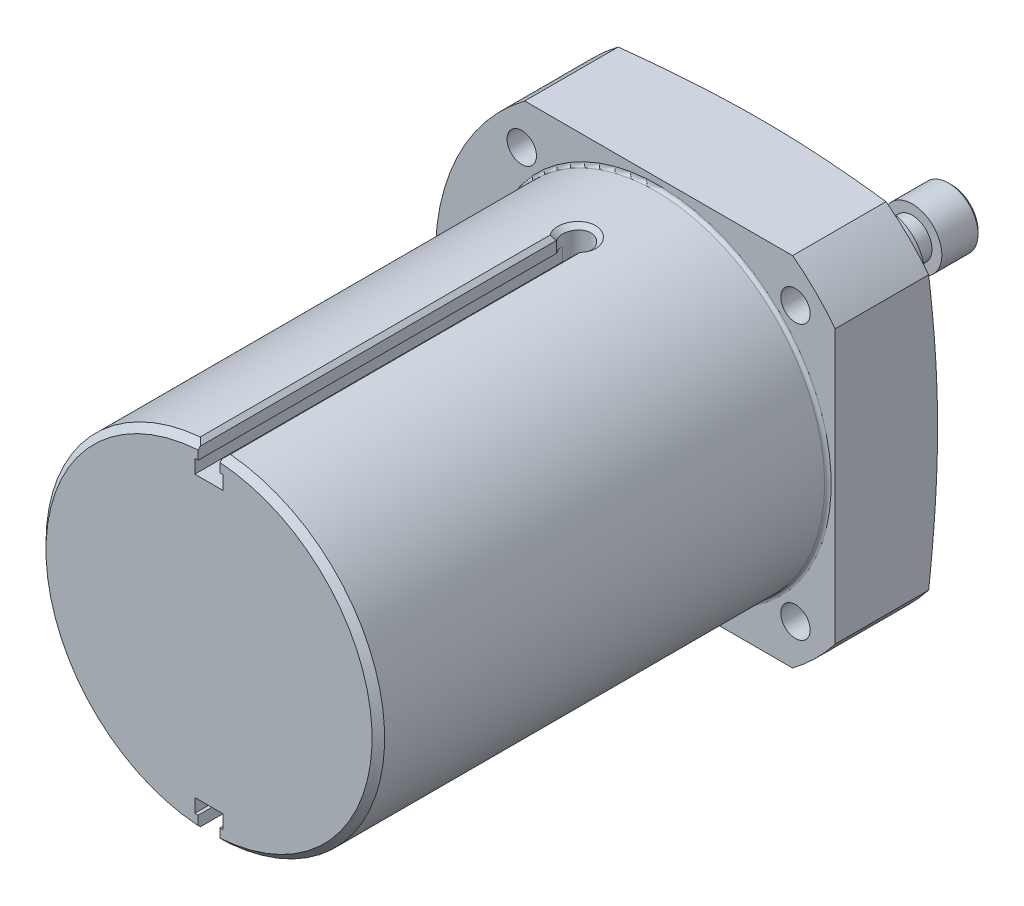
SolidWorks part; units mm, degrees
ref_plane "Front Plane" through (0, 0, 0) normal (0, 0, 1) x (1, 0, 0)
ref_plane "Top Plane" through (0, 0, 0) normal (0, 1, 0) x (1, 0, 0)
ref_plane "Right Plane" through (0, 0, 0) normal (1, 0, 0) x (0, 0, -1)
sketch "Sketch1" plane through (0, 0, 0) normal (0, 0, 1) x (1, 0, 0)
  line L0 (0, 0) -> (62.0084, 0) construction
  line L1 (-32.385, 43.18) -> (32.385, 43.18)
  line L2 (42.6974, 33.0187) -> (42.6974, -33.0187)
  line L3 (-32.385, -43.18) -> (32.385, -43.18)
  arc A0 (-32.385, 43.18) -> (-32.385, -43.18) centre (0, 0) ccw
  arc A1 (42.6974, 33.0187) -> (32.385, 43.18) centre (0, 0) ccw
  arc A2 (32.385, -43.18) -> (42.6974, -33.0187) centre (0, 0) ccw
  dimension "D1" = 107.95
  dimension "D2" = 86.36
  dimension "D3" = 42.6974
extrude "Extrude1" add sketch "Sketch1" along normal blind 138.938
sketch "Sketch2" plane through (0, 0, 0) normal (0, 1, 0) x (1, 0, 0)
  line L0 (0, 0) -> (0, -96.9332) construction
  line L1 (-53.975, -30.226) -> (-40.9448, -30.226)
  line L2 (-53.975, 0) -> (-53.975, -138.938) construction
  line L3 (-40.9448, -30.226) -> (-40.9448, -138.938)
  line L5 (-13.97, 0) -> (-53.975, -7.62)
  line L6 (32.385, 0) -> (-32.385, 0) construction
  line L7 (-40.9448, -138.938) -> (-53.975, -138.938)
  line L8 (-53.975, -138.938) -> (-53.975, -30.226)
  line L9 (-53.975, -7.62) -> (-53.975, 0)
  line L10 (-32.385, 0) -> (-53.975, 0) construction
  line L11 (-53.975, 0) -> (-13.97, 0)
  dimension "D1" = 108.712
  dimension "D2" = 81.8896
  dimension "D5" = 27.94
  dimension "D6" = 7.62
revolve "Cut-Revolve1" cut sketch "Sketch2" angle 360 about L0
sketch "Sketch4" plane through (0, 0, 0) normal (0, 1, 0) x (1, 0, 0)
  line L0 (0, 0) -> (0, -99.9671) construction
  line L1 (9.5186, 0) -> (9.5187, 12.065)
  line L2 (13.97, 0) -> (-13.97, 0) construction
  line L3 (9.5187, 12.065) -> (9.1122, 24.9969)
  line L4 (9.1122, 24.9969) -> (0, 24.9969)
  line L5 (-32.385, -30.226) -> (32.385, -30.226) construction
  line L7 (0, 24.9969) -> (0, 0)
  line L8 (0, 0) -> (9.5186, 0)
  dimension "D1" = 1.8
  dimension "D2" = 42.291
  dimension "D4" = 19.0373
  dimension "D5" = 18.2245
  dimension "D6" = 12.9319
revolve "Revolve1" add sketch "Sketch4" angle 360 about L0
hole_wizard "Hole1" positions "Sketch6" profile "Sketch5" legacy
sketch "Sketch6" plane through (0, 0, -24.9969) normal (0, 0, -1) x (-1, 0, 0)
  circle A0 centre (0, 0) radius 9.1122 construction
  point P0 (0, 0)
sketch "Sketch5" plane through (0, 0, -24.9969) normal (1, 0, 0) x (0, 1, 0)
  line L0 (0, 0) -> (0, 21.5835)
  line L1 (0, 21.5835) -> (4.2164, 19.05)
  line L2 (4.2164, 19.05) -> (4.2164, 0)
  line L4 (4.2164, 0) -> (0, 0)
  line L6 (0, 21.5835) -> (-4.2164, 19.05) construction
  line L7 (0, -4.2442) -> (0, 117.3081) construction
  dimension "Diameter" = 8.4328
  dimension "Depth" = 19.05
  dimension "Drill Angle" = 118
hole_wizard "Hole2" positions "Sketch10" profile "Sketch9" legacy
sketch "Sketch10" plane through (4.4648, 0.3939, 0) normal (0, 0, 1) x (1, 0, 0)
  line L1 (-4.4648, -0.3939) -> (19.5659, -0.3939) construction
  line L2 (-4.4648, -0.3939) -> (28.6274, 32.6984) construction
  circle A0 centre (-4.4648, -0.3939) radius 46.7995 construction
  point P0 (28.6274, 32.6984)
  dimension "D2" = 93.599
  dimension "D1" = 45
sketch "Sketch9" plane through (33.0922, 33.0922, 0) normal (1, 0, 0) x (0, 1, 0)
  line L0 (0, 0) -> (0, 30.227)
  line L1 (0, 30.227) -> (3.556, 30.227)
  line L2 (3.556, 30.227) -> (3.556, 11.43)
  line L3 (3.556, 11.43) -> (5.5499, 11.43)
  line L4 (5.5499, 11.43) -> (5.5499, 0)
  line L5 (5.5499, 0) -> (0, 0)
  line L6 (0, 110) -> (0, -10) construction
  dimension "Diameter" = 7.112
  dimension "Depth" = 30.227
  dimension "C-Bore Diameter" = 11.0998
  dimension "C-Bore Depth" = 11.43
pattern_circular "CirPattern1" count 4 over 360 about axis through (0, 0, 0) along (0, 0, 1) of "Hole2"
ref_plane "Plane1" through (0, 0, 22.3012) normal (0, 0, 1) x (1, 0, 0)
sketch "Sketch11" plane through (0, 0, 22.3012) normal (0, 0, 1) x (1, 0, 0)
  line L0 (0, 0) -> (19.628, -9.1527) construction
  line L1 (0, 0) -> (27.0444, 0) construction
  line L2 (-88.1553, 36.5113) -> (-42.1149, 15.0423)
  line L3 (-42.1149, 15.0423) -> (-40.3544, 18.8176)
  line L4 (-40.3544, 18.8176) -> (-86.3949, 40.2866)
  line L5 (-86.3949, 40.2866) -> (-88.1553, 36.5113)
  dimension "D1" = 25
  dimension "D2" = 44.5262
  dimension "D3" = 8.3312
  dimension "D4" = 50.8
revolve "Cut-Revolve2" cut sketch "Sketch11" angle 360 about L0
mirror "Mirror1" about plane through (0, 0, 0) normal (0, 1, 0) of "Cut-Revolve2"
sketch "Sketch12" plane through (0, 0, 138.938) normal (0, 0, 1) x (1, 0, 0)
  line L0 (0, 0) -> (0, 26.7352) construction
  line L1 (-2.6416, 50.8) -> (-2.6416, 37.1602)
  line L2 (-2.6416, 37.1602) -> (-3.429, 37.1602)
  line L3 (-3.429, 37.1602) -> (-3.429, 33.8582)
  line L4 (-3.429, 33.8582) -> (3.429, 33.8582)
  line L5 (3.429, 37.1602) -> (3.429, 33.8582)
  line L6 (2.6416, 37.1602) -> (3.429, 37.1602)
  line L7 (2.6416, 50.8) -> (2.6416, 37.1602)
  line L8 (-2.6416, 50.8) -> (2.6416, 50.8)
  dimension "D1" = 5.2832
  dimension "D2" = 6.858
  dimension "D3" = 3.302
  dimension "D4" = 33.8582
  dimension "D5" = 50.8
extrude "Cut-Extrude1" cut sketch "Sketch12" against normal blind 88.9
sketch "Sketch13" plane through (0, 0, 138.938) normal (0, 0, 1) x (1, 0, 0)
  line L0 (0, 0) -> (32.0428, 0) construction
  line L1 (0, 0) -> (0, -27.5102) construction
  line L2 (-3.429, -33.8582) -> (3.429, -33.8582)
  line L3 (3.429, -33.8582) -> (3.429, -37.1602)
  line L4 (3.429, -37.1602) -> (2.6416, -37.1602)
  line L5 (2.6416, -37.1602) -> (2.6416, -50.8)
  line L6 (2.6416, -50.8) -> (-2.6416, -50.8)
  line L7 (-3.429, 33.8582) -> (3.429, 33.8582) construction
  line L8 (3.429, 37.1602) -> (3.429, 33.8582) construction
  line L9 (2.6416, 50.8) -> (2.6416, 37.1602) construction
  line L10 (-2.6416, -37.1602) -> (-2.6416, -50.8)
  line L11 (-3.429, -37.1602) -> (-2.6416, -37.1602)
  line L12 (-3.429, -33.8582) -> (-3.429, -37.1602)
extrude "Cut-Extrude2" cut sketch "Sketch13" against normal blind 73.152
sketch "Sketch14" plane through (0, 43.18, 0) normal (0, 1, 0) x (1, 0, 0)
  line L0 (-2.6416, -50.038) -> (2.6416, -50.038) construction
  circle A0 centre (0, -50.038) radius 3.429
  dimension "D1" = 3.429
extrude "Cut-Extrude3" cut sketch "Sketch14" against normal up to surface (9.3218 mm away)
sketch "Sketch15" plane through (0, -43.18, 0) normal (0, -1, 0) x (1, 0, 0)
  line L0 (3.429, 65.786) -> (-3.429, 65.786) construction
  circle A0 centre (0, 65.786) radius 3.429
  dimension "D1" = 3.429
extrude "Cut-Extrude4" cut sketch "Sketch15" against normal up to surface (9.3218 mm away)
sketch "Sketch16" plane through (0, 0, 0) normal (0, 1, 0) x (1, 0, 0)
  line L0 (0, 0) -> (0, -122.9241) construction
  line L1 (4.7625, 24.9969) -> (4.7625, 31.115)
  line L2 (9.1122, 24.9969) -> (-9.1122, 24.9969) construction
  line L3 (4.7625, 31.115) -> (7.1374, 31.115)
  line L4 (7.1374, 31.115) -> (7.1374, 39.878)
  line L5 (7.1374, 39.878) -> (6.3754, 40.64)
  line L6 (6.3754, 40.64) -> (0, 40.64)
  line L7 (0, 40.64) -> (0, 24.9969)
  line L8 (0, 24.9969) -> (4.7625, 24.9969)
  line L9 (-9.5187, 12.065) -> (9.5187, 12.065) construction
  dimension "D1" = 9.525
  dimension "D2" = 19.05
  dimension "D3" = 14.2748
  dimension "D4" = 9.525
  dimension "D5" = 45
  dimension "D6" = 12.7508
revolve "Revolve2" add sketch "Sketch16" angle 360 about L0
sketch "Sketch17" plane through (0, 0, -40.64) normal (0, 0, -1) x (-1, 0, 0)
  line L1 (3.9624, -2.2877) -> (3.9624, 2.2877)
  line L2 (3.9624, 2.2877) -> (0, 4.5754)
  line L3 (0, 4.5754) -> (-3.9624, 2.2877)
  line L4 (-3.9624, 2.2877) -> (-3.9624, -2.2877)
  line L5 (-3.9624, -2.2877) -> (0, -4.5754)
  line L6 (0, -4.5754) -> (3.9624, -2.2877)
  circle A0 centre (0, 0) radius 3.9624 construction
  dimension "D1" = 7.9248
extrude "Cut-Extrude5" cut sketch "Sketch17" against normal blind 6.35
chamfer "Chamfer1" distance 1.524 angle 45 2 edges at (-40.9448, 0, 138.938) (40.9448, 0, 138.938)
fillet "Fillet1" radius 0.7874 1 edges at (-40.9448, 0, 30.226)
chamfer "Chamfer2" distance 0.9906 angle 47.56 6 edges at (2.6416, -40.8595, 102.6932) (-0.372, -40.9431, 69.1948) (-2.6416, -40.8595, 102.6932) (-2.6416, 40.8595, 94.8192) (-0.372, 40.9431, 46.6292) (2.6416, 40.8595, 94.8192)
